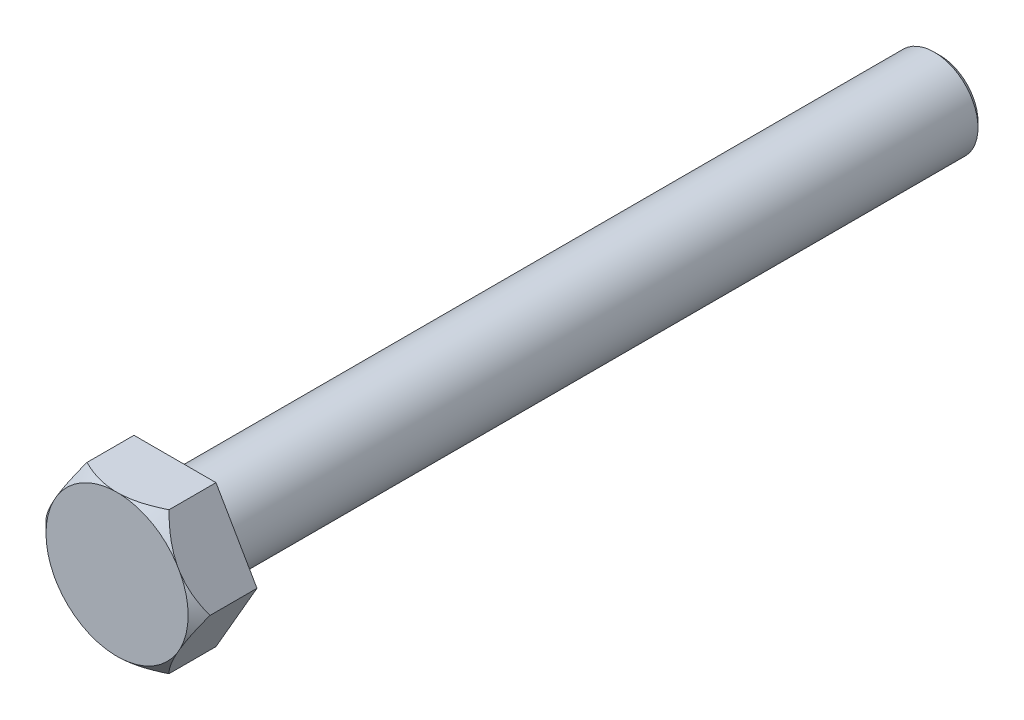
SolidWorks part; units mm, degrees
ref_plane "Plan de face" through (0, 0, 0) normal (0, 0, 1) x (1, 0, 0)
ref_plane "Plan de dessus" through (0, 0, 0) normal (0, 1, 0) x (1, 0, 0)
ref_plane "Plan de droite" through (0, 0, 0) normal (1, 0, 0) x (0, 0, -1)
sketch "Esquisse1" plane through (0, 0, 0) normal (0, 0, 1) x (1, 0, 0)
  line L1 (7.5056, 0) -> (3.7528, 6.5)
  line L2 (3.7528, 6.5) -> (-3.7528, 6.5)
  line L3 (-3.7528, 6.5) -> (-7.5056, 0)
  line L4 (-7.5056, 0) -> (-3.7528, -6.5)
  line L5 (-3.7528, -6.5) -> (3.7528, -6.5)
  line L6 (3.7528, -6.5) -> (7.5056, 0)
  circle A0 centre (0, 0) radius 6.5 construction
  dimension "D1" = 13
extrude "Boss.-Extru.1" add sketch "Esquisse1" along normal blind 5.3
sketch "Esquisse3" plane through (0, 0, 0) normal (0, 1, 0) x (1, 0, 0)
  line L0 (0, 2.9031) -> (0, -10.4428) construction
  line L1 (-7.5056, -4.3) -> (-6.5056, -5.3)
  line L2 (-9.0249, -6.1429) -> (-6.5056, -6.1429)
  line L3 (-9.0249, -6.1429) -> (-9.0249, -4.3)
  line L4 (-9.0249, -4.3) -> (-7.5056, -4.3)
  line L5 (-6.5056, -6.1429) -> (-6.5056, -5.3)
  line L6 (-7.5056, -5.3) -> (-7.5056, 0) construction
  line L8 (-3.7528, -5.3) -> (-7.5056, -5.3) construction
  dimension "D1" = 1
  dimension "D2" = 1
revolve "Enlèvement de matière-Révolution2" cut sketch "Esquisse3" angle 360 about L0
sketch "Esquisse4" plane through (0, 0, 0) normal (1, 0, 0) x (0, 0, -1)
  line L0 (0, 0) -> (83.8832, 0) construction
  line L1 (0, -4) -> (69.5, -4)
  line L2 (0, -6.5) -> (0, 0) construction
  line L3 (70, -3.5) -> (70, 0)
  line L4 (69.5, -4) -> (70, -3.5)
  line L5 (0, -4) -> (0, 0)
  line L6 (0, 0) -> (70, 0)
  point P4 (70, -4)
  dimension "D1" = 4
  dimension "D2" = 70
  dimension "D6" = 0.5
revolve "Révolution2" add sketch "Esquisse4" angle 360 about L0
